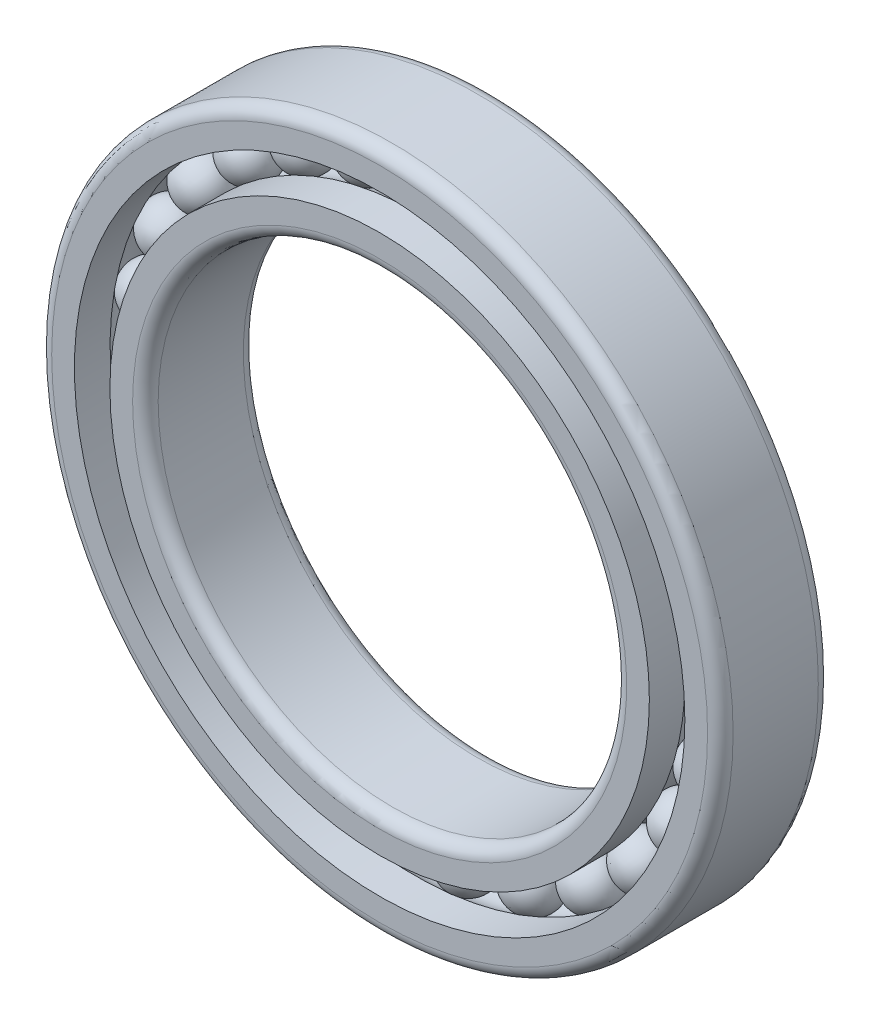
SolidWorks part; units mm, degrees
ref_plane "Front Plane" through (0, 0, 0) normal (0, 0, 1) x (1, 0, 0)
ref_plane "Top Plane" through (0, 0, 0) normal (0, 1, 0) x (1, 0, 0)
ref_plane "Right Plane" through (0, 0, 0) normal (1, 0, 0) x (0, 0, -1)
other "Configuration Table"
sketch "BaseSke" plane through (0, 0, 0) normal (1, 0, 0) x (0, 0, -1)
  line L0 (-47.2296, 0) -> (24.6132, 0) construction
  line L1 (-47.2296, 33.75) -> (24.6132, 33.75) construction
  line L2 (0, 129.5214) -> (0, -86.3012) construction
  line L3 (0, 36.875) -> (0, 30.625)
  line L4 (-6.5, 40) -> (6.5, 40) construction
  line L5 (-6.5, 27.5) -> (6.5, 27.5) construction
  arc A0 (0, 36.875) -> (0, 30.625) centre (0, 33.75) ccw
revolve "Ball" add sketch "BaseSke" angle 360 about L3
sketch "OuterRaceSke" plane through (0, 0, 0) normal (1, 0, 0) x (0, 0, -1)
  line L0 (0, 0) -> (0, 87.5396) construction
  line L1 (-6.5, 40) -> (6.5, 40)
  line L2 (-6.5, 40) -> (-6.5, 35.8333)
  line L3 (-6.5, 35.8333) -> (-2.3158, 35.8333)
  line L4 (6.5, 40) -> (6.5, 35.8333)
  line L5 (-50.3916, 0) -> (55.2197, 0) construction
  line L6 (-47.2296, 33.75) -> (24.6132, 33.75) construction
  line L7 (2.3158, 35.8333) -> (6.5, 35.8333)
  arc A0 (2.3158, 35.8333) -> (-2.3158, 35.8333) centre (0, 33.75) ccw
revolve "OuterRace" add sketch "OuterRaceSke" angle 360 about L5
sketch "InnerRaceSke" plane through (0, 0, 0) normal (1, 0, 0) x (0, 0, -1)
  line L0 (-70.8626, 0) -> (113.5527, 0) construction
  line L1 (0, 58.441) -> (0, -70.8113) construction
  line L2 (-6.5, 27.5) -> (6.5, 27.5)
  line L3 (-6.5, 27.5) -> (-6.5, 31.6667)
  line L4 (-6.5, 31.6667) -> (-2.3158, 31.6667)
  line L5 (6.5, 27.5) -> (6.5, 31.6667)
  line L6 (0, 129.5214) -> (0, -86.3012) construction
  line L7 (2.3158, 31.6667) -> (6.5, 31.6667)
  arc A0 (-2.3158, 31.6667) -> (2.3158, 31.6667) centre (0, 33.75) ccw
  arc A1 (0, 36.875) -> (0, 30.625) centre (0, 33.75) ccw construction
revolve "InnerRace" add sketch "InnerRaceSke" angle 360 about L0
fillet "Fillet1" radius 1.5 4 edges at (27.5, 0, -6.5) (27.5, 0, 6.5) (40, 0, -6.5) (40, 0, 6.5)
sketch "ShieldedSke" plane through (0, 0, 0) normal (1, 0, 0) x (0, 0, -1)
  line L1 (-5.75, 35.8333) -> (-4.3333, 35.8333)
  line L2 (-6.5, 35.0833) -> (-6.5, 32.4167)
  line L3 (-5.75, 31.6667) -> (-4.3333, 31.6667)
  line L4 (-4.3333, 35.8333) -> (-4.3333, 31.6667)
  arc A0 (-5.75, 35.8333) -> (-6.5, 35.0833) centre (-5.75, 35.0833) ccw
  arc A1 (-6.5, 32.4167) -> (-5.75, 31.6667) centre (-5.75, 32.4167) ccw
  point P12 (-6.5, 35.8333)
  point P13 (-6.5, 31.6667)
revolve "Shielded" [suppressed] add sketch "ShieldedSke" angle 360 about L0
mirror "DoubleShielded" [suppressed] about plane through (0, 0, 0) normal (0, 0, 1)
sketch "SealedSke" plane through (0, 0, 0) normal (1, 0, 0) x (0, 0, -1)
  line L0 (-34.5153, 0) -> (39.09, 0) construction
  line L1 (-25.2, 31.6667) -> (-5.2, 31.6667)
  line L2 (-25.2, 31.6667) -> (-25.2, 35.8333)
  line L3 (-25.2, 35.8333) -> (-5.2, 35.8333)
  line L4 (-5.2, 31.6667) -> (-5.2, 35.8333)
revolve "Sealed" [suppressed] cut sketch "SealedSke" angle 360 about L0
mirror "DoubleSealed" [suppressed] about plane through (0, 0, 0) normal (0, 0, 1)
pattern_circular "CirPatternBall" count 27 over 360 about axis through (0, 0, 0) along (0, 0, 1) of "Ball"
sketch "CutGrooveSke" plane through (0, 0, 0) normal (1, 0, 0) x (0, 0, -1)
  line L0 (-51.8407, 0) -> (83.8302, 0) construction
  line L1 (3.9, -59.2) -> (3.25, -59.2)
  line L2 (3.9, -59.2) -> (3.9, -39.2)
  line L3 (3.9, -39.2) -> (3.25, -39.2)
  line L4 (3.25, -59.2) -> (3.25, -39.2)
revolve "CutGroove" [suppressed] cut sketch "CutGrooveSke" angle 360 about L0
sketch "TaperSke" plane through (0, 0, 0) normal (1, 0, 0) x (0, 0, -1)
  line L0 (-6.5, 27.5) -> (6.5, 27.5)
  line L1 (6.5, 27.5) -> (6.5, 28.5833)
  line L2 (6.5, 28.5833) -> (-6.5, 27.5)
  line L7 (-41.2502, 0) -> (40.8606, 0) construction
revolve "Taper" [suppressed] cut sketch "TaperSke" angle 360 about L7
fillet "Fillet2" [suppressed] radius 1.5
sketch "SimplifiedSke" plane through (0, 0, 0) normal (1, 0, 0) x (0, 0, -1)
  line L0 (37.5911, 0) -> (-37.5911, 0) construction
  circle A0 centre (0, 33.75) radius 3.125
  arc A1 (0, 36.875) -> (0, 30.625) centre (0, 33.75) ccw construction
revolve "Simplified" [suppressed] add sketch "SimplifiedSke" angle 360 about L0
equation "\"D1@BaseSke\" =  (\"Bearing_Outside_Diameter@BaseSke\"  +  \"Bearing_Inside_Diameter@BaseSke\"  )  / 4"
equation "\"Ball_diameter@BaseSke\" =  ( \"Bearing_Outside_Diameter@BaseSke\" - \"Bearing_Inside_Diameter@BaseSke\" ) / 4 "
equation "\"D2@OuterRaceSke\" = \"Bearing_Outside_Diameter@BaseSke\" -  ( \"Bearing_Outside_Diameter@BaseSke\" - \"Bearing_Inside_Diameter@BaseSke\" )  / 3"
equation "\"D4@OuterRaceSke\" = (  \"Bearing_Outside_Diameter@BaseSke\" - \"Bearing_Inside_Diameter@BaseSke\" ) / 4 -0.02"
equation "\"D1@InnerRaceSke\" = \"Bearing_Inside_Diameter@BaseSke\" +  ( \"Bearing_Outside_Diameter@BaseSke\" - \"Bearing_Inside_Diameter@BaseSke\" )  / 3"
equation "\"D2@InnerRaceSke\" = \"D4@OuterRaceSke\""
equation "\"D1@ShieldedSke\" = \"Fillet_radius@Fillet1\"/2"
equation "\"D2@ShieldedSke\" = \"Bearing_Thickness@BaseSke\"/3"
equation "\"D2@SealedSke\" = \"Bearing_Thickness@BaseSke\"/2.5"
equation "\"D1@CirPatternBall\" = int( \"D1@BaseSke\"* pi  * 2 / \"Ball_diameter@BaseSke\"/1.2 ) -1"
equation "\"D1@CutGrooveSke\" = \"Bearing_Outside_Diameter@BaseSke\" * 0.49"
equation "\"D2@CutGrooveSke\" = \"Bearing_Thickness@BaseSke\" *0.25"
equation "\"D3@CutGrooveSke\" = \"Bearing_Thickness@BaseSke\"/20"
equation "\"Taper@TaperSke\" = \"Bearing_Thickness@BaseSke\"/12"
equation "\"D1@Fillet2\" = \"Fillet_radius@Fillet1\""
